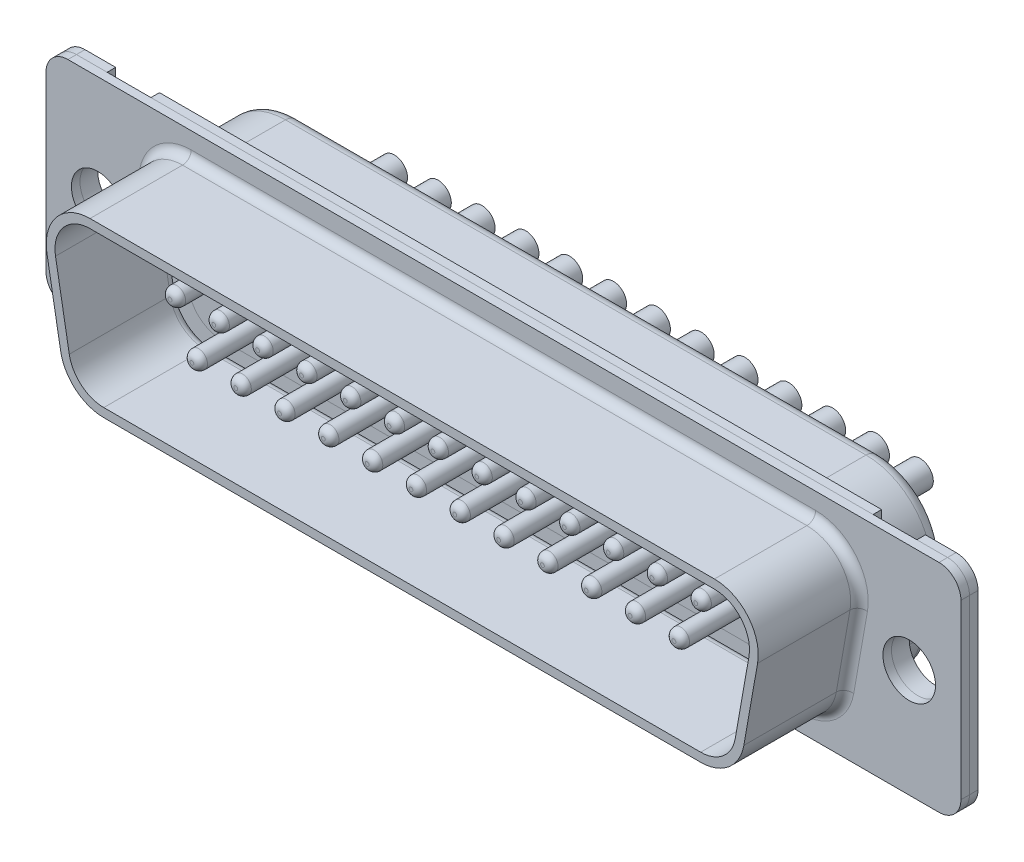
SolidWorks part; units mm, degrees
ref_plane "Front" through (0, 0, 0) normal (0, 0, 1) x (1, 0, 0)
ref_plane "Top" through (0, 0, 0) normal (0, 1, 0) x (1, 0, 0)
ref_plane "Right" through (0, 0, 0) normal (1, 0, 0) x (0, 0, -1)
sketch "Sketch1" plane through (0, 0, 0) normal (0, 0, 1) x (1, 0, 0)
  line L0 (-26.5176, -6.2738) -> (26.5176, 6.2738) construction
  line L1 (-25.2476, -6.2738) -> (25.2476, -6.2738)
  line L2 (-26.5176, -5.0038) -> (-26.5176, 5.0038)
  line L3 (-25.2476, 6.2738) -> (25.2476, 6.2738)
  line L4 (26.5176, -5.0038) -> (26.5176, 5.0038)
  arc A0 (-26.5176, 5.0038) -> (-25.2476, 6.2738) centre (-25.2476, 5.0038) cw
  arc A1 (-25.2476, -6.2738) -> (-26.5176, -5.0038) centre (-25.2476, -5.0038) cw
  arc A2 (26.5176, -5.0038) -> (25.2476, -6.2738) centre (25.2476, -5.0038) cw
  arc A3 (25.2476, 6.2738) -> (26.5176, 5.0038) centre (25.2476, 5.0038) cw
  dimension "D3" = 1.27
  dimension "D1" = 53.0352
  dimension "D2" = 12.5476
extrude "Extrude1" add sketch "Sketch1" against normal blind 0.4953
sketch "Sketch2" plane through (0, 0, 0) normal (0, 0, 1) x (1, 0, 0)
  line L0 (19.8017, -2.7017) -> (19.8017, 7.2586) construction
  line L1 (20.5989, 1.8195) -> (19.8017, -2.7017)
  line L2 (17.3003, -4.8006) -> (-17.3003, -4.8006)
  line L3 (-20.5989, 1.8195) -> (-19.8017, -2.7017)
  line L4 (0, 4.8006) -> (0, -4.8006) construction
  line L5 (-18.0975, 4.8006) -> (18.0975, 4.8006)
  line L6 (-18.0975, 4.2926) -> (18.0975, 4.2926)
  line L7 (20.0986, 1.9077) -> (19.3014, -2.6135)
  line L8 (17.3003, -4.2926) -> (-17.3003, -4.2926)
  line L9 (-20.0986, 1.9077) -> (-19.3014, -2.6135)
  arc A0 (18.0975, 4.8006) -> (20.5989, 1.8195) centre (18.0975, 2.2606) cw
  arc A1 (19.8017, -2.7017) -> (17.3003, -4.8006) centre (17.3003, -2.2606) cw
  arc A2 (-19.8017, -2.7017) -> (-17.3003, -4.8006) centre (-17.3003, -2.2606) ccw
  arc A3 (-18.0975, 4.8006) -> (-20.5989, 1.8195) centre (-18.0975, 2.2606) ccw
  arc A4 (18.0975, 4.2926) -> (20.0986, 1.9077) centre (18.0975, 2.2606) cw
  arc A5 (19.3014, -2.6135) -> (17.3003, -4.2926) centre (17.3003, -2.2606) cw
  arc A6 (-19.3014, -2.6135) -> (-17.3003, -4.2926) centre (-17.3003, -2.2606) ccw
  arc A7 (-18.0975, 4.2926) -> (-20.0986, 1.9077) centre (-18.0975, 2.2606) ccw
  point P8 (0, 0)
  dimension "D3" = 41.275
  dimension "D4" = 2.54
  dimension "D5" = 2.032
  dimension "D1" = 10
  dimension "D2" = 9.6012
extrude "Extrude2" add sketch "Sketch2" along normal blind 5.8674
hole_wizard "#31 (0.12) Diameter Hole1" positions "Sketch4" profile "Sketch3" hole size "#31" standard "Ansi Inch"
sketch "Sketch4" plane through (0, 0, 0) normal (0, 0, 1) x (1, 0, 0)
  line L0 (8.1305, 0) -> (-8.1305, 0) construction
  line L1 (0, -6.9012) -> (0, 6.9012) construction
  point P0 (-23.5204, 0)
  point P1 (23.5204, 0)
  dimension "D1" = 47.0408
  dimension "D2" = 23.5204
sketch "Sketch3" plane through (-23.5204, 0, 0) normal (1, 0, 0) x (0, -1, 0)
  line L0 (0, 0) -> (0, 0.4953)
  line L1 (0, 0.4953) -> (1.524, 0.4953)
  line L2 (1.524, 0.4953) -> (1.524, 0)
  line L5 (1.524, 0) -> (0, 0)
  line L11 (0, -6.35) -> (0, 107.95) construction
  dimension "Thru Hole Dia." = 3.048
  dimension "Thru Hole Depth" = 0.4953
sketch "Sketch5" plane through (0, 0, 0) normal (0, 0, 1) x (1, 0, 0)
  line L4 (18.0975, 4.2926) -> (-18.0975, 4.2926)
  line L5 (-20.0986, 1.9077) -> (-19.3014, -2.6135)
  line L6 (-17.3003, -4.2926) -> (17.3003, -4.2926)
  line L7 (19.3014, -2.6135) -> (20.0986, 1.9077)
  line L8 (18.0975, 4.2926) -> (-18.0975, 4.2926)
  line L9 (-20.0986, 1.9077) -> (-19.3014, -2.6135)
  line L10 (-17.3003, -4.2926) -> (17.3003, -4.2926)
  line L11 (19.3014, -2.6135) -> (20.0986, 1.9077)
  arc A4 (-18.0975, 4.2926) -> (-20.0986, 1.9077) centre (-18.0975, 2.2606) ccw
  arc A5 (-19.3014, -2.6135) -> (-17.3003, -4.2926) centre (-17.3003, -2.2606) ccw
  arc A6 (17.3003, -4.2926) -> (19.3014, -2.6135) centre (17.3003, -2.2606) ccw
  arc A7 (20.0986, 1.9077) -> (18.0975, 4.2926) centre (18.0975, 2.2606) ccw
  arc A8 (-18.0975, 4.2926) -> (-20.0986, 1.9077) centre (-18.0975, 2.2606) ccw
  arc A9 (-19.3014, -2.6135) -> (-17.3003, -4.2926) centre (-17.3003, -2.2606) ccw
  arc A10 (17.3003, -4.2926) -> (19.3014, -2.6135) centre (17.3003, -2.2606) ccw
  arc A11 (20.0986, 1.9077) -> (18.0975, 4.2926) centre (18.0975, 2.2606) ccw
  dimension "D1" = 0
extrude "Cut-Extrude1" cut sketch "Sketch5" against normal through all
fillet "Fillet1" radius 0.508 8 edges at (0, 4.8006, 0) (20.0433, 3.8933, 0) (20.2003, -0.4411, 0) (18.933, -4.2064, 0) (0, -4.8006, 0) (-18.933, -4.2064, 0) (-20.2003, -0.4411, 0) (-20.0433, 3.8933, 0)
fillet "Fillet2" radius 0.508 8 edges at (19.7, -0.3529, -0.4953) (18.6064, -3.8172, -0.4953) (0, -4.2926, -0.4953) (-18.6064, -3.8172, -0.4953) (-19.7, -0.3529, -0.4953) (-19.6541, 3.5667, -0.4953) (0, 4.2926, -0.4953) (19.6541, 3.5667, -0.4953)
sketch "Sketch6" plane through (0, 0, -0.4953) normal (0, 0, -1) x (-1, 0, 0)
  line L0 (-26.5176, 0) -> (26.5176, 0) construction
  line L1 (-23.4696, -6.2738) -> (-23.4696, -4.6228)
  line L2 (0, 6.2738) -> (0, -6.2738) construction
  line L3 (-23.4696, 6.2738) -> (-23.4696, 4.6228)
  line L4 (25.2476, 6.2738) -> (-25.2476, 6.2738)
  line L5 (-26.5176, 5.0038) -> (-26.5176, -5.0038)
  line L6 (-25.2476, -6.2738) -> (25.2476, -6.2738)
  line L7 (26.5176, -5.0038) -> (26.5176, 5.0038)
  line L8 (25.2476, 6.2738) -> (23.4696, 6.2738)
  line L9 (-26.5176, 5.0038) -> (-26.5176, -5.0038)
  line L10 (-25.2476, -6.2738) -> (-23.4696, -6.2738)
  line L11 (26.5176, -5.0038) -> (26.5176, 5.0038)
  line L12 (-23.4696, 4.6228) -> (-20.9296, 4.6228)
  line L13 (-20.9296, 6.2738) -> (-20.9296, 4.6228)
  line L14 (23.4696, -4.6228) -> (20.9296, -4.6228)
  line L15 (-20.9296, -6.2738) -> (-20.9296, -4.6228)
  line L16 (-23.4696, -4.6228) -> (-20.9296, -4.6228)
  line L17 (20.9296, -6.2738) -> (20.9296, -4.6228)
  line L18 (20.9296, 6.2738) -> (20.9296, 4.6228)
  line L19 (23.4696, 4.6228) -> (20.9296, 4.6228)
  line L20 (23.4696, 6.2738) -> (23.4696, 4.6228)
  line L21 (23.4696, -6.2738) -> (23.4696, -4.6228)
  line L22 (-23.4696, 6.2738) -> (-25.2476, 6.2738)
  line L23 (-20.9296, -6.2738) -> (20.9296, -6.2738)
  line L24 (23.4696, -6.2738) -> (25.2476, -6.2738)
  line L25 (20.9296, 6.2738) -> (-20.9296, 6.2738)
  arc A4 (26.5176, 5.0038) -> (25.2476, 6.2738) centre (25.2476, 5.0038) ccw
  arc A5 (-25.2476, 6.2738) -> (-26.5176, 5.0038) centre (-25.2476, 5.0038) ccw
  arc A6 (-26.5176, -5.0038) -> (-25.2476, -6.2738) centre (-25.2476, -5.0038) ccw
  arc A7 (25.2476, -6.2738) -> (26.5176, -5.0038) centre (25.2476, -5.0038) ccw
  arc A8 (26.5176, 5.0038) -> (25.2476, 6.2738) centre (25.2476, 5.0038) ccw
  arc A9 (-25.2476, 6.2738) -> (-26.5176, 5.0038) centre (-25.2476, 5.0038) ccw
  arc A10 (-26.5176, -5.0038) -> (-25.2476, -6.2738) centre (-25.2476, -5.0038) ccw
  arc A11 (25.2476, -6.2738) -> (26.5176, -5.0038) centre (25.2476, -5.0038) ccw
  dimension "D2" = 3.048
  dimension "D3" = 2.54
  dimension "D4" = 1.651
  dimension "D1" = 0
extrude "Extrude3" add sketch "Sketch6" along normal blind 0.4953 separate body
hole_wizard "#31 (0.12) Diameter Hole2" positions "Sketch8" profile "Sketch7" hole size "#31" standard "Ansi Inch"
sketch "Sketch8" plane through (0, 0, -0.4953) normal (0, 0, 1) x (1, 0, 0)
  circle A0 centre (23.5204, 0) radius 1.524 construction
  circle A1 centre (-23.5204, 0) radius 1.524 construction
  point P0 (-23.5204, 0)
  point P1 (23.5204, 0)
sketch "Sketch7" plane through (-23.5204, 0, -0.4953) normal (1, 0, 0) x (0, -1, 0)
  line L0 (0, 0) -> (0, 0.4953)
  line L1 (0, 0.4953) -> (1.524, 0.4953)
  line L2 (1.524, 0.4953) -> (1.524, 0)
  line L5 (1.524, 0) -> (0, 0)
  line L11 (0, -6.35) -> (0, 107.95) construction
  dimension "Thru Hole Dia." = 3.048
  dimension "Thru Hole Depth" = 0.4953
sketch "Sketch9" plane through (0, 0, -0.9906) normal (0, 0, -1) x (-1, 0, 0)
  line L4 (-18.0975, 4.8006) -> (18.0975, 4.8006) construction
  line L5 (-19.8017, -2.7017) -> (-20.5989, 1.8195) construction
  line L6 (20.5989, 1.8195) -> (19.8017, -2.7017) construction
  line L7 (0, 6.9012) -> (0, -6.9012) construction
  line L9 (8.1305, 0) -> (-8.1305, 0) construction
  line L12 (-20.5796, 0.8878) -> (-20.0332, -2.211)
  line L13 (-16.2811, -5.3594) -> (16.2811, -5.3594)
  line L14 (20.0332, -2.211) -> (20.5796, 0.8878)
  line L15 (16.8275, 5.3594) -> (-16.8275, 5.3594)
  arc A12 (-16.8275, 5.3594) -> (-20.5796, 0.8878) centre (-16.8275, 1.5494) ccw
  arc A13 (-20.0332, -2.211) -> (-16.2811, -5.3594) centre (-16.2811, -1.5494) ccw
  arc A14 (16.2811, -5.3594) -> (20.0332, -2.211) centre (16.2811, -1.5494) ccw
  arc A15 (20.5796, 0.8878) -> (16.8275, 5.3594) centre (16.8275, 1.5494) ccw
  dimension "D1" = 3.81
  dimension "D3" = 41.275
  dimension "D2" = 20.6375
  dimension "D4" = 5.3594
  dimension "D5" = 10.7188
extrude "Extrude4" add sketch "Sketch9" along normal offset from surface (3.9624 mm away) 10.8204
sketch "Sketch10" plane through (0, 0, -0.9906) normal (0, 0, -1) x (-1, 0, 0)
  circle A0 centre (-23.5204, 0) radius 2.3178
  circle A1 centre (23.5204, 0) radius 2.3178
  circle A2 centre (23.5204, 0) radius 1.524 construction
  circle A3 centre (-23.5204, 0) radius 1.524 construction
  circle A4 centre (-23.5204, 0) radius 1.524
  circle A5 centre (23.5204, 0) radius 1.524
  dimension "D1" = 4.6355
extrude "Extrude5" add sketch "Sketch10" along normal blind 0.5334
sketch "Sketch11" plane through (0, 0, -4.953) normal (0, 0, -1) x (-1, 0, 0)
  line L4 (16.8275, 5.3594) -> (-16.8275, 5.3594) construction
  line L5 (-20.5796, 0.8878) -> (-20.0332, -2.211) construction
  line L6 (20.0332, -2.211) -> (20.5796, 0.8878) construction
  line L7 (-16.2811, -5.3594) -> (16.2811, -5.3594) construction
  line L12 (17.5395, 3.8354) -> (-17.5395, 3.8354)
  line L13 (-19.4155, 1.5996) -> (-18.7348, -2.2612)
  line L14 (-16.8587, -3.8354) -> (16.8587, -3.8354)
  line L15 (18.7348, -2.2612) -> (19.4155, 1.5996)
  arc A12 (-17.5395, 3.8354) -> (-19.4155, 1.5996) centre (-17.5395, 1.9304) ccw
  arc A13 (-18.7348, -2.2612) -> (-16.8587, -3.8354) centre (-16.8587, -1.9304) ccw
  arc A14 (16.8587, -3.8354) -> (18.7348, -2.2612) centre (16.8587, -1.9304) ccw
  arc A15 (19.4155, 1.5996) -> (17.5395, 3.8354) centre (17.5395, 1.9304) ccw
  dimension "D3" = 1.905
  dimension "D1" = 1.524
  dimension "D2" = 1.524
  dimension "D4" = 1.27
  dimension "D5" = 1.27
extrude "Cut-Extrude2" cut sketch "Sketch11" against normal up to surface (3.9624 mm away)
fillet "Fillet3" radius 0.762 8 edges at (-19.7461, 3.9984, -4.953) (-20.3064, -0.6616, -4.953) (-18.7301, -4.468, -4.953) (0, -5.3594, -4.953) (18.7301, -4.468, -4.953) (20.3064, -0.6616, -4.953) (19.7461, 3.9984, -4.953) (0, 5.3594, -4.953)
sketch "Sketch14" plane through (0, 0, -0.9906) normal (0, 0, -1) x (-1, 0, 0)
  line L4 (17.5395, 3.8354) -> (-17.5395, 3.8354)
  line L5 (-19.4155, 1.5996) -> (-18.7348, -2.2612)
  line L6 (-16.8587, -3.8354) -> (16.8587, -3.8354)
  line L7 (18.7348, -2.2612) -> (19.4155, 1.5996)
  line L8 (17.5395, 3.8354) -> (-17.5395, 3.8354)
  line L9 (-19.4155, 1.5996) -> (-18.7348, -2.2612)
  line L10 (-16.8587, -3.8354) -> (16.8587, -3.8354)
  line L11 (18.7348, -2.2612) -> (19.4155, 1.5996)
  arc A4 (19.4155, 1.5996) -> (17.5395, 3.8354) centre (17.5395, 1.9304) ccw
  arc A5 (-17.5395, 3.8354) -> (-19.4155, 1.5996) centre (-17.5395, 1.9304) ccw
  arc A6 (-18.7348, -2.2612) -> (-16.8587, -3.8354) centre (-16.8587, -1.9304) ccw
  arc A7 (16.8587, -3.8354) -> (18.7348, -2.2612) centre (16.8587, -1.9304) ccw
  arc A8 (19.4155, 1.5996) -> (17.5395, 3.8354) centre (17.5395, 1.9304) ccw
  arc A9 (-17.5395, 3.8354) -> (-19.4155, 1.5996) centre (-17.5395, 1.9304) ccw
  arc A10 (-18.7348, -2.2612) -> (-16.8587, -3.8354) centre (-16.8587, -1.9304) ccw
  arc A11 (16.8587, -3.8354) -> (18.7348, -2.2612) centre (16.8587, -1.9304) ccw
  dimension "D1" = 0
extrude "Cut-Extrude3" cut sketch "Sketch14" against normal through all
sketch "Sketch13" plane through (0, 0, -0.4953) normal (0, 0, -1) x (-1, 0, 0)
  line L0 (17.5395, 3.8354) -> (-17.5395, 3.8354) construction
  line L1 (-16.8587, -3.8354) -> (16.8587, -3.8354) construction
  line L2 (-19.4155, 1.5996) -> (-18.7348, -2.2612) construction
  line L3 (18.7348, -2.2612) -> (19.4155, 1.5996) construction
  line L8 (17.5395, 3.8354) -> (-17.5395, 3.8354)
  line L9 (-19.4155, 1.5996) -> (-18.7348, -2.2612)
  line L10 (-16.8587, -3.8354) -> (16.8587, -3.8354)
  line L11 (18.7348, -2.2612) -> (19.4155, 1.5996)
  arc A1 (-17.5395, 3.8354) -> (-19.4155, 1.5996) centre (-17.5395, 1.9304) ccw construction
  arc A2 (-18.7348, -2.2612) -> (-16.8587, -3.8354) centre (-16.8587, -1.9304) ccw construction
  arc A3 (16.8587, -3.8354) -> (18.7348, -2.2612) centre (16.8587, -1.9304) ccw construction
  arc A4 (19.4155, 1.5996) -> (17.5395, 3.8354) centre (17.5395, 1.9304) ccw construction
  arc A8 (19.4155, 1.5996) -> (17.5395, 3.8354) centre (17.5395, 1.9304) ccw
  arc A9 (-17.5395, 3.8354) -> (-19.4155, 1.5996) centre (-17.5395, 1.9304) ccw
  arc A10 (-18.7348, -2.2612) -> (-16.8587, -3.8354) centre (-16.8587, -1.9304) ccw
  arc A11 (16.8587, -3.8354) -> (18.7348, -2.2612) centre (16.8587, -1.9304) ccw
extrude "Extrude7" add sketch "Sketch13" along normal blind 4.8133 separate body
sketch "Sketch15" plane through (0, 0, -5.3086) normal (0, 0, -1) x (-1, 0, 0)
  line L0 (-15.24, 2.3495) -> (-15.24, 0.1905) construction
  line L1 (-16.1798, 1.8011) -> (-16.1798, 0.7389)
  line L2 (-14.3002, 1.8011) -> (-14.3002, 0.7389)
  line L3 (-11.7602, 1.8011) -> (-11.7602, 0.7389)
  line L4 (-13.6398, 1.8011) -> (-13.6398, 0.7389)
  line L5 (-9.2202, 1.8011) -> (-9.2202, 0.7389)
  line L6 (-11.0998, 1.8011) -> (-11.0998, 0.7389)
  line L7 (-6.6802, 1.8011) -> (-6.6802, 0.7389)
  line L8 (-8.5598, 1.8011) -> (-8.5598, 0.7389)
  line L9 (-4.1402, 1.8011) -> (-4.1402, 0.7389)
  line L10 (-6.0198, 1.8011) -> (-6.0198, 0.7389)
  line L11 (-1.6002, 1.8011) -> (-1.6002, 0.7389)
  line L12 (-3.4798, 1.8011) -> (-3.4798, 0.7389)
  line L13 (0.9398, 1.8011) -> (0.9398, 0.7389)
  line L14 (-0.9398, 1.8011) -> (-0.9398, 0.7389)
  line L15 (3.4798, 1.8011) -> (3.4798, 0.7389)
  line L16 (1.6002, 1.8011) -> (1.6002, 0.7389)
  line L17 (6.0198, 1.8011) -> (6.0198, 0.7389)
  line L18 (4.1402, 1.8011) -> (4.1402, 0.7389)
  line L19 (8.5598, 1.8011) -> (8.5598, 0.7389)
  line L20 (6.6802, 1.8011) -> (6.6802, 0.7389)
  line L21 (11.0998, 1.8011) -> (11.0998, 0.7389)
  line L22 (9.2202, 1.8011) -> (9.2202, 0.7389)
  line L23 (13.6398, 1.8011) -> (13.6398, 0.7389)
  line L24 (11.7602, 1.8011) -> (11.7602, 0.7389)
  line L25 (16.1798, 1.8011) -> (16.1798, 0.7389)
  line L26 (14.3002, 1.8011) -> (14.3002, 0.7389)
  line L27 (-15.24, 1.27) -> (15.24, 1.27) construction
  line L28 (8.1305, 0) -> (-8.1305, 0) construction
  line L29 (0, 6.9012) -> (0, -6.9012) construction
  line L30 (-13.0302, -0.7389) -> (-13.0302, -1.8011)
  line L31 (-14.9098, -0.7389) -> (-14.9098, -1.8011)
  line L32 (-13.97, -2.3495) -> (-13.97, -0.1905) construction
  line L33 (-10.4902, -0.7389) -> (-10.4902, -1.8011)
  line L34 (-12.3698, -0.7389) -> (-12.3698, -1.8011)
  line L35 (-8.89, -2.3495) -> (-8.89, -0.1905) construction
  line L36 (-7.9502, -0.7389) -> (-7.9502, -1.8011)
  line L37 (-9.8298, -0.7389) -> (-9.8298, -1.8011)
  line L38 (-6.35, -2.3495) -> (-6.35, -0.1905) construction
  line L39 (-5.4102, -0.7389) -> (-5.4102, -1.8011)
  line L40 (-7.2898, -0.7389) -> (-7.2898, -1.8011)
  line L41 (-3.81, -2.3495) -> (-3.81, -0.1905) construction
  line L42 (-2.8702, -0.7389) -> (-2.8702, -1.8011)
  line L43 (-4.7498, -0.7389) -> (-4.7498, -1.8011)
  line L44 (-1.27, -2.3495) -> (-1.27, -0.1905) construction
  line L45 (-0.3302, -0.7389) -> (-0.3302, -1.8011)
  line L46 (-2.2098, -0.7389) -> (-2.2098, -1.8011)
  line L47 (1.27, -2.3495) -> (1.27, -0.1905) construction
  line L48 (2.2098, -0.7389) -> (2.2098, -1.8011)
  line L49 (0.3302, -0.7389) -> (0.3302, -1.8011)
  line L50 (3.81, -2.3495) -> (3.81, -0.1905) construction
  line L51 (4.7498, -0.7389) -> (4.7498, -1.8011)
  line L52 (2.8702, -0.7389) -> (2.8702, -1.8011)
  line L53 (6.35, -2.3495) -> (6.35, -0.1905) construction
  line L54 (7.2898, -0.7389) -> (7.2898, -1.8011)
  line L55 (5.4102, -0.7389) -> (5.4102, -1.8011)
  line L56 (8.89, -2.3495) -> (8.89, -0.1905) construction
  line L57 (9.8298, -0.7389) -> (9.8298, -1.8011)
  line L58 (7.9502, -0.7389) -> (7.9502, -1.8011)
  line L59 (11.43, -2.3495) -> (11.43, -0.1905) construction
  line L60 (12.3698, -0.7389) -> (12.3698, -1.8011)
  line L61 (10.4902, -0.7389) -> (10.4902, -1.8011)
  line L62 (13.97, -2.3495) -> (13.97, -0.1905) construction
  line L63 (14.9098, -0.7389) -> (14.9098, -1.8011)
  line L64 (13.0302, -0.7389) -> (13.0302, -1.8011)
  line L66 (-13.97, -1.27) -> (13.97, -1.27) construction
  line L67 (-11.43, -2.3495) -> (-11.43, -0.1905) construction
  arc A0 (-14.3002, 1.8011) -> (-16.1798, 1.8011) centre (-15.24, 1.27) ccw
  arc A1 (-16.1798, 0.7389) -> (-14.3002, 0.7389) centre (-15.24, 1.27) ccw
  arc A2 (-11.7602, 1.8011) -> (-13.6398, 1.8011) centre (-12.7, 1.27) ccw
  arc A3 (-13.6398, 0.7389) -> (-11.7602, 0.7389) centre (-12.7, 1.27) ccw
  arc A4 (-9.2202, 1.8011) -> (-11.0998, 1.8011) centre (-10.16, 1.27) ccw
  arc A5 (-11.0998, 0.7389) -> (-9.2202, 0.7389) centre (-10.16, 1.27) ccw
  arc A6 (-6.6802, 1.8011) -> (-8.5598, 1.8011) centre (-7.62, 1.27) ccw
  arc A7 (-8.5598, 0.7389) -> (-6.6802, 0.7389) centre (-7.62, 1.27) ccw
  arc A8 (-4.1402, 1.8011) -> (-6.0198, 1.8011) centre (-5.08, 1.27) ccw
  arc A9 (-6.0198, 0.7389) -> (-4.1402, 0.7389) centre (-5.08, 1.27) ccw
  arc A10 (-1.6002, 1.8011) -> (-3.4798, 1.8011) centre (-2.54, 1.27) ccw
  arc A11 (-3.4798, 0.7389) -> (-1.6002, 0.7389) centre (-2.54, 1.27) ccw
  arc A12 (0.9398, 1.8011) -> (-0.9398, 1.8011) centre (0, 1.27) ccw
  arc A13 (-0.9398, 0.7389) -> (0.9398, 0.7389) centre (0, 1.27) ccw
  arc A14 (3.4798, 1.8011) -> (1.6002, 1.8011) centre (2.54, 1.27) ccw
  arc A15 (1.6002, 0.7389) -> (3.4798, 0.7389) centre (2.54, 1.27) ccw
  arc A16 (6.0198, 1.8011) -> (4.1402, 1.8011) centre (5.08, 1.27) ccw
  arc A17 (4.1402, 0.7389) -> (6.0198, 0.7389) centre (5.08, 1.27) ccw
  arc A18 (8.5598, 1.8011) -> (6.6802, 1.8011) centre (7.62, 1.27) ccw
  arc A19 (6.6802, 0.7389) -> (8.5598, 0.7389) centre (7.62, 1.27) ccw
  arc A20 (11.0998, 1.8011) -> (9.2202, 1.8011) centre (10.16, 1.27) ccw
  arc A21 (9.2202, 0.7389) -> (11.0998, 0.7389) centre (10.16, 1.27) ccw
  arc A22 (13.6398, 1.8011) -> (11.7602, 1.8011) centre (12.7, 1.27) ccw
  arc A23 (11.7602, 0.7389) -> (13.6398, 0.7389) centre (12.7, 1.27) ccw
  arc A24 (16.1798, 1.8011) -> (14.3002, 1.8011) centre (15.24, 1.27) ccw
  arc A25 (14.3002, 0.7389) -> (16.1798, 0.7389) centre (15.24, 1.27) ccw
  arc A26 (-13.0302, -0.7389) -> (-14.9098, -0.7389) centre (-13.97, -1.27) ccw
  arc A27 (-14.9098, -1.8011) -> (-13.0302, -1.8011) centre (-13.97, -1.27) ccw
  arc A28 (-10.4902, -0.7389) -> (-12.3698, -0.7389) centre (-11.43, -1.27) ccw
  arc A29 (-12.3698, -1.8011) -> (-10.4902, -1.8011) centre (-11.43, -1.27) ccw
  arc A30 (-7.9502, -0.7389) -> (-9.8298, -0.7389) centre (-8.89, -1.27) ccw
  arc A31 (-9.8298, -1.8011) -> (-7.9502, -1.8011) centre (-8.89, -1.27) ccw
  arc A32 (-5.4102, -0.7389) -> (-7.2898, -0.7389) centre (-6.35, -1.27) ccw
  arc A33 (-7.2898, -1.8011) -> (-5.4102, -1.8011) centre (-6.35, -1.27) ccw
  arc A34 (-2.8702, -0.7389) -> (-4.7498, -0.7389) centre (-3.81, -1.27) ccw
  arc A35 (-4.7498, -1.8011) -> (-2.8702, -1.8011) centre (-3.81, -1.27) ccw
  arc A36 (-0.3302, -0.7389) -> (-2.2098, -0.7389) centre (-1.27, -1.27) ccw
  arc A37 (-2.2098, -1.8011) -> (-0.3302, -1.8011) centre (-1.27, -1.27) ccw
  arc A38 (2.2098, -0.7389) -> (0.3302, -0.7389) centre (1.27, -1.27) ccw
  arc A39 (0.3302, -1.8011) -> (2.2098, -1.8011) centre (1.27, -1.27) ccw
  arc A40 (4.7498, -0.7389) -> (2.8702, -0.7389) centre (3.81, -1.27) ccw
  arc A41 (2.8702, -1.8011) -> (4.7498, -1.8011) centre (3.81, -1.27) ccw
  arc A42 (7.2898, -0.7389) -> (5.4102, -0.7389) centre (6.35, -1.27) ccw
  arc A43 (5.4102, -1.8011) -> (7.2898, -1.8011) centre (6.35, -1.27) ccw
  arc A44 (9.8298, -0.7389) -> (7.9502, -0.7389) centre (8.89, -1.27) ccw
  arc A45 (7.9502, -1.8011) -> (9.8298, -1.8011) centre (8.89, -1.27) ccw
  arc A46 (12.3698, -0.7389) -> (10.4902, -0.7389) centre (11.43, -1.27) ccw
  arc A47 (10.4902, -1.8011) -> (12.3698, -1.8011) centre (11.43, -1.27) ccw
  arc A48 (14.9098, -0.7389) -> (13.0302, -0.7389) centre (13.97, -1.27) ccw
  arc A49 (13.0302, -1.8011) -> (14.9098, -1.8011) centre (13.97, -1.27) ccw
  dimension "D1" = 2.159
  dimension "D4" = 2.54
  dimension "D6" = 1.0795
  dimension "D10" = 2.54
  dimension "D11" = 1.27
  dimension "D2" = 0.9398
  dimension "D3" = 1.8796
  dimension "D5" = 1.27
  dimension "D7" = 0.9398
  dimension "D8" = 1.8796
  dimension "D9" = 2.54
extrude "Cut-Extrude4" cut sketch "Sketch15" against normal blind 3.81
sketch "Sketch16" plane through (0, 0, -0.4953) normal (0, 0, 1) x (1, 0, 0)
  circle A0 centre (-15.24, 1.27) radius 1.0795
  arc A1 (-14.3002, 1.8011) -> (-16.1798, 1.8011) centre (-15.24, 1.27) ccw construction
  circle A2 centre (-12.7, 1.27) radius 1.0795
  circle A3 centre (-10.16, 1.27) radius 1.0795
  circle A4 centre (-7.62, 1.27) radius 1.0795
  circle A5 centre (-5.08, 1.27) radius 1.0795
  circle A6 centre (-2.54, 1.27) radius 1.0795
  circle A7 centre (0, 1.27) radius 1.0795
  circle A8 centre (2.54, 1.27) radius 1.0795
  circle A9 centre (5.08, 1.27) radius 1.0795
  circle A10 centre (7.62, 1.27) radius 1.0795
  circle A11 centre (10.16, 1.27) radius 1.0795
  circle A12 centre (12.7, 1.27) radius 1.0795
  circle A13 centre (15.24, 1.27) radius 1.0795
  circle A14 centre (13.97, -1.27) radius 1.0795
  circle A15 centre (11.43, -1.27) radius 1.0795
  circle A16 centre (8.89, -1.27) radius 1.0795
  circle A17 centre (6.35, -1.27) radius 1.0795
  circle A18 centre (3.81, -1.27) radius 1.0795
  circle A19 centre (1.27, -1.27) radius 1.0795
  circle A20 centre (-1.27, -1.27) radius 1.0795
  circle A21 centre (-3.81, -1.27) radius 1.0795
  circle A22 centre (-6.35, -1.27) radius 1.0795
  circle A23 centre (-8.89, -1.27) radius 1.0795
  circle A24 centre (-11.43, -1.27) radius 1.0795
  circle A25 centre (-13.97, -1.27) radius 1.0795
extrude "Cut-Extrude5" cut sketch "Sketch16" against normal up to surface (1.0033 mm away)
sketch "Sketch17" plane through (0, 0, -5.3086) normal (0, 0, -1) x (-1, 0, 0)
  line L2 (-16.1798, 1.8011) -> (-16.1798, 0.7389)
  line L3 (-14.3002, 0.7389) -> (-14.3002, 1.8011)
  line L4 (-16.1798, 1.8011) -> (-16.1798, 0.7389)
  line L5 (-14.3002, 0.7389) -> (-14.3002, 1.8011)
  arc A2 (-16.1798, 0.7389) -> (-14.3002, 0.7389) centre (-15.24, 1.27) ccw
  arc A3 (-14.3002, 1.8011) -> (-16.1798, 1.8011) centre (-15.24, 1.27) ccw
  arc A4 (-16.1798, 0.7389) -> (-14.3002, 0.7389) centre (-15.24, 1.27) ccw
  arc A5 (-14.3002, 1.8011) -> (-16.1798, 1.8011) centre (-15.24, 1.27) ccw
  dimension "D1" = 0
extrude "Extrude8" add sketch "Sketch17" against normal blind 3.81 separate body
sketch "Sketch18" plane through (0, 0, -5.3086) normal (0, 0, -1) x (-1, 0, 0)
  circle A0 centre (-15.24, 1.27) radius 0.5588
  circle A1 centre (-15.24, 1.27) radius 0.762
  dimension "D1" = 1.524
  dimension "D2" = 1.1176
extrude "Extrude10" add sketch "Sketch18" along direction (0, 0, -1) on the side of the normal offset from surface (3.6068 mm away) 7.9248
sketch "Sketch19" plane through (0, 0, -1.4986) normal (0, 0, 1) x (1, 0, 0)
  circle A0 centre (15.24, 1.27) radius 0.508
  arc A1 (16.1798, 1.8011) -> (14.3002, 1.8011) centre (15.24, 1.27) ccw construction
  dimension "D1" = 1.016
extrude "Extrude11" add sketch "Sketch19" along normal blind 5.588
fillet "Fillet4" radius 0.3969 1 edges at (15.748, 1.27, 4.0894)
pattern_linear "LPattern1" count 13 spacing 2.54 along (-1, 0, 0)
move or copy body "Body-Move/Copy1" bodies to move or copy 117
pattern_linear "LPattern2" count 12 spacing 2.54 along (-1, 0, 0)
